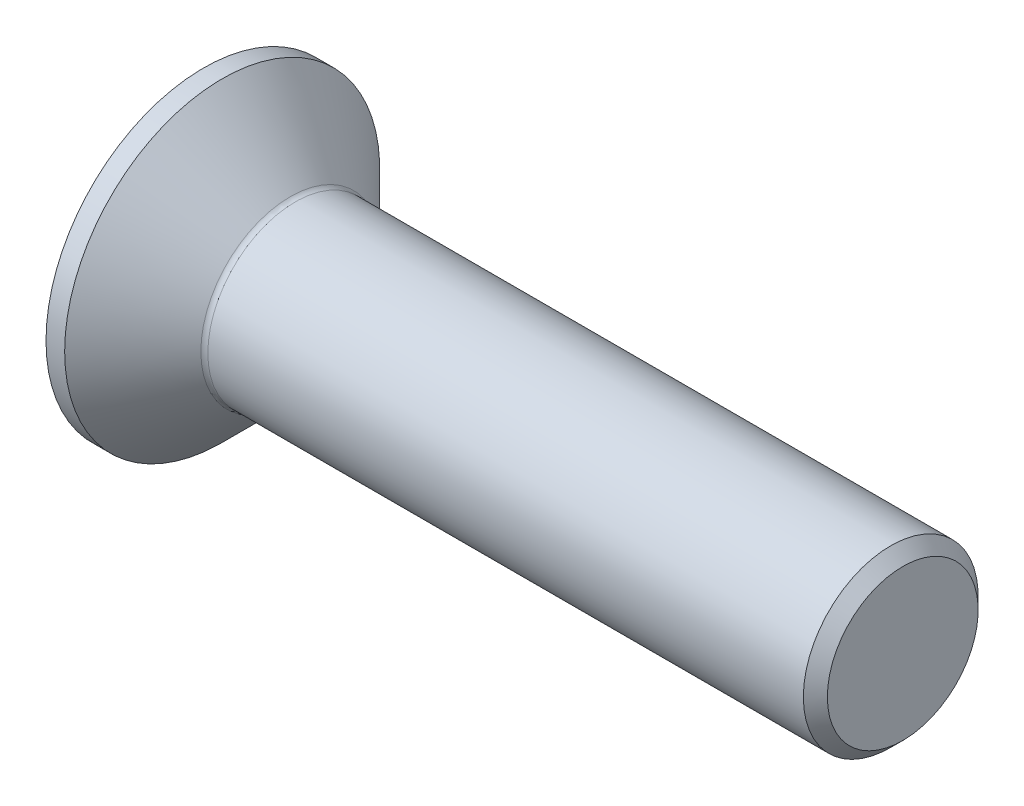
SolidWorks part; units mm, degrees
revolve "PreBroach" cut sketch "Sketch2"
sketch "Sketch2"
  line L0 (0, 6) -> (5.6, 6)
  line L1 (5.6, 6) -> (9.0641, 0)
  line L2 (0, 0) -> (127, 0) construction
  line L3 (9.0641, 0) -> (0, 0)
  line L4 (0, 0) -> (0, 6)
  line L5 (0, -6) -> (5.6, -6) construction
  line L6 (0, 0) -> (47.625, 0) construction
  line L8 (0, 18.025) -> (0, -18.025) construction
revolve "BaseBody" add sketch "BodySke" angle 360 about L6
sketch "BodySke" plane through (0, 0, 0) normal (0, 0, 1) x (1, 0, 0)
  line L0 (0, 0) -> (0, 18.025)
  line L1 (2.135, 18.025) -> (10.16, 10)
  line L2 (0, 18.025) -> (2.135, 18.025)
  line L3 (10.16, 10) -> (78.626, 10)
  line L4 (80, 8.626) -> (80, 0)
  line L5 (80, 0) -> (0, 0)
  line L6 (0, 0) -> (127, 0) construction
  line L7 (2.135, -18.025) -> (10.16, -10) construction
  line L8 (80, 8.626) -> (78.626, 10)
  line L9 (0, -18.025) -> (2.135, -18.025) construction
  line L10 (80, -8.626) -> (78.626, -10) construction
  line L11 (12.66, 16.35) -> (12.66, -5.875) construction
  line L12 (0, 19.05) -> (0, -3.175) construction
ref_plane "Plane1" through (0, 0, 0) normal (0, 0, 1) x (1, 0, 0)
ref_plane "Plane2" through (0, 0, 0) normal (0, 1, 0) x (1, 0, 0)
ref_plane "Plane3" through (0, 0, 0) normal (1, 0, 0) x (0, 0, -1)
other "Configuration Table"
fillet "Fillet1" radius 0.8 1 edges at (10.16, 0, 10)
sketch "Sketch3" plane through (0, 0, 0) normal (-1, 0, 0) x (0, 0, 1)
  line L0 (-6, -3.4641) -> (-6, 3.4641)
  line L1 (-6, 3.4641) -> (0, 6.9282)
  line L2 (0, 6.9282) -> (6, 3.4641)
  line L3 (6, 3.4641) -> (6, -3.4641)
  line L4 (6, -3.4641) -> (0, -6.9282)
  line L5 (0, -6.9282) -> (-6, -3.4641)
extrude "Hex" cut sketch "Sketch3" against normal blind 5.6
sketch "ThdSchSke" plane through (0, 0, 0) normal (0, 0, 1) x (1, 0, 0)
  line L0 (15.16, -8.626) -> (14.1979, -10)
  line L1 (15.16, -8.626) -> (16.1221, -10)
  line L2 (16.1221, -10) -> (16.1221, -12.5)
  line L3 (-3.175, 0) -> (5.1513, 0) construction
  line L4 (0, 18.025) -> (0, -18.025) construction
  line L5 (16.1221, -12.5) -> (14.1979, -12.5)
  line L6 (14.1979, -12.5) -> (14.1979, -10)
revolve "ThreadSchematic" [suppressed] cut sketch "ThdSchSke" angle 360 about L3
pattern_linear "ThdSchPat" [suppressed]
equation "\"Thread_minor@ThreadCosmetic\"  =  \"Minor_dia@BodySke\""
equation "\"D1@Sketch3\" = \"Hex_size@Sketch3\" / 2"
equation "\"D2@Sketch3\" = \"D1@Sketch3\""
equation "\"D3@Sketch3\" = \"Hex_size@Sketch3\""
equation "\"Thread_length@ThreadCosmetic\" = ((sgn( (\"Length@BodySke\" - \"Advance@BodySke\" * 2.0 - \"Head_ht@BodySke\" ) - \"Thread_nom@BodySke\" )-1)*( (\"Length@BodySke\" - \"Advance@BodySke\" * 2.0 - \"Head_ht@BodySke\" "
equation "\"Thread_minor@ThdSchSke\" = \"Minor_dia@BodySke\""
equation "\"Diameter@ThdSchSke\" = \"Diameter@BodySke\""
equation "\"Overcut@ThdSchSke\" = \"Diameter@BodySke\" * 1.25"
equation "\"Start@ThdSchSke\" = 0.000001 + \"Length@BodySke\" - \"Thread_length@ThreadCosmetic\"  '---Countersunk---"
equation "\"Num_threads@ThdSchPat\" = int( \"Thread_length@ThreadCosmetic\" / \"Advance@BodySke\" + 0.999 )  + 1"
equation "\"Advance@ThdSchPat\" = \"Thread_length@ThreadCosmetic\" /  (\"Num_threads@ThdSchPat\" - 1) 'relax it"
equation "\"Num_threads@ThdSchPat\" = \"Num_threads@ThdSchPat\" - sgn( \"Num_threads@ThdSchPat\" - 1) '---chamfered tips only---"
